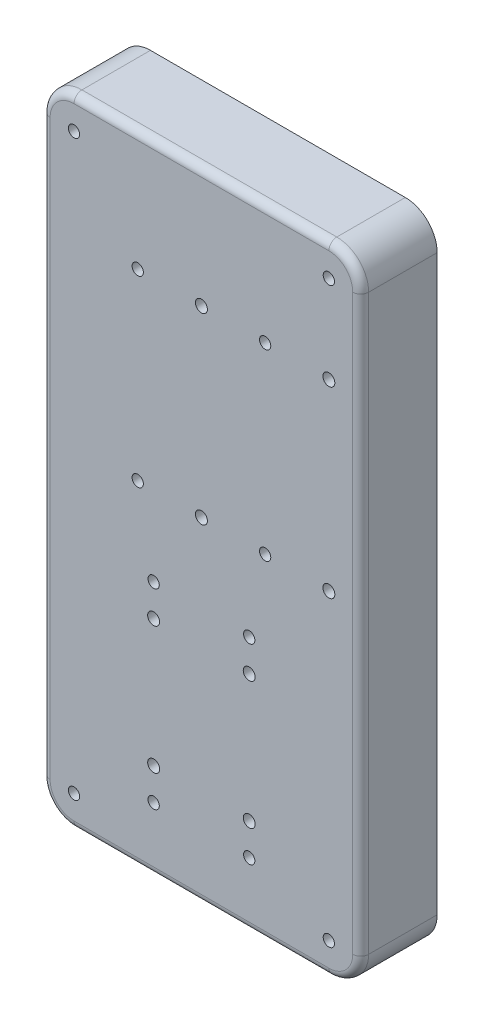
SolidWorks part; units mm, degrees
ref_plane "Front Plane" through (0, 0, 0) normal (0, 0, 1) x (1, 0, 0)
ref_plane "Top Plane" through (0, 0, 0) normal (0, 1, 0) x (1, 0, 0)
ref_plane "Right Plane" through (0, 0, 0) normal (1, 0, 0) x (0, 0, -1)
sketch "Sketch1" plane through (0, 0, 0) normal (0, 0, 1) x (1, 0, 0)
  line L0 (0, 0) -> (63.5, 0) construction
  line L1 (-63.5, 127) -> (63.5, 127)
  line L2 (-63.5, 127) -> (-63.5, -127)
  line L3 (-63.5, -127) -> (63.5, -127)
  line L4 (63.5, 127) -> (63.5, -127)
  line L5 (0, 0) -> (0, 62.3384) construction
  dimension "D1" = 254
  dimension "D2" = 127
extrude "Extrude1" add sketch "Sketch1" along normal blind 30.48
hole_wizard "CSK for #8 Flat Head Machine Screw1" positions "Sketch3" profile "Sketch2" countersink size "#8" standard "Ansi Inch"
sketch "Sketch3" plane through (0, 0, 0) normal (0, 0, -1) x (-1, 0, 0)
  line L0 (0, 0) -> (0, 58.5095) construction
  line L1 (0, 0) -> (26.0664, 0) construction
  point P0 (25.4, 79.375)
  point P1 (-25.4, 79.375)
  point P3 (25.4, 6.35)
  point P5 (-25.4, 6.35)
  point P14 (-19.05, -25.4)
  point P16 (-19.05, -101.6)
  point P18 (19.05, -101.6)
  point P20 (19.05, -25.4)
  dimension "D1" = 50.8
  dimension "D2" = 73.025
  dimension "D3" = 79.375
  dimension "D4" = 76.2
  dimension "D5" = 38.1
  dimension "D6" = 25.4
sketch "Sketch2" plane through (-25.4, 79.375, 0) normal (1, 0, 0) x (0, 1, 0)
  line L0 (0, 0) -> (0, 30.48)
  line L1 (0, 30.48) -> (2.2479, 30.48)
  line L2 (2.2479, 30.48) -> (2.2479, 3.0265)
  line L3 (2.2479, 3.0265) -> (4.8788, 0)
  line L5 (4.8788, 0) -> (0, 0)
  line L6 (-2.2479, 3.0265) -> (-4.8788, 0) construction
  line L11 (0, -6.35) -> (0, 107.95) construction
  dimension "Thru Hole Dia." = 4.4958
  dimension "Thru Hole Depth" = 30.48
  dimension "Near C'Sink Dia." = 9.7576
  dimension "Near C'Sink Angle" = 82
sketch "Sketch4" plane through (0, 0, 0) normal (0, 0, -1) x (-1, 0, 0)
  line L0 (-25.4, 79.375) -> (25.4, 79.375) construction
  line L1 (-25.4, 6.35) -> (25.4, 6.35) construction
  line L2 (19.05, -101.6) -> (19.05, -25.4) construction
  line L3 (-19.05, -25.4) -> (-19.05, -101.6) construction
  circle A5 centre (19.05, -101.6) radius 2.2479 construction
  circle A6 centre (25.4, 79.375) radius 2.2479 construction
  circle A7 centre (-25.4, 6.35) radius 2.2479 construction
  circle A8 centre (19.05, -25.4) radius 2.2479 construction
  circle A9 centre (-19.05, -101.6) radius 2.2479 construction
  circle A10 centre (19.05, -88.9) radius 2.3813
  circle A11 centre (19.05, -38.1) radius 2.3813
  circle A12 centre (-19.05, -38.1) radius 2.3813
  circle A13 centre (-19.05, -88.9) radius 2.3813
  circle A14 centre (0, 6.35) radius 2.3813
  circle A15 centre (-50.8, 6.35) radius 2.3812
  circle A16 centre (-50.8, 79.375) radius 2.3812
  circle A17 centre (0, 79.375) radius 2.3812
  dimension "D1" = 4.7625
  dimension "D2" = 25.4
  dimension "D3" = 25.4
  dimension "D4" = 12.7
  dimension "D5" = 12.7
extrude "Cut-Extrude1" cut sketch "Sketch4" against normal through all
fillet "Fillet1" radius 12.7 4 edges at (-63.5, 127, 15.24) (63.5, 127, 15.24) (63.5, -127, 15.24) (-63.5, -127, 15.24)
fillet "Fillet2" radius 3.175 8 edges at (59.7803, -123.2803, 30.48) (0, -127, 30.48) (-59.7803, -123.2803, 30.48) (-63.5, 0, 30.48) (-59.7803, 123.2803, 30.48) (0, 127, 30.48) (59.7803, 123.2803, 30.48) (63.5, 0, 30.48)
hole_wizard "#8 Clearance Hole1" positions "Sketch6" profile "Sketch5" hole size "#8" standard "Ansi Inch"
sketch "Sketch6" plane through (0, 0, 30.48) normal (0, 0, 1) x (1, 0, 0)
  line L0 (0, 0) -> (0, 105.9704) construction
  line L1 (0, 0) -> (100.393, 0) construction
  point P0 (-50.8, 114.3)
  point P1 (50.8, 114.3)
  point P3 (50.8, -114.3)
  point P5 (-50.8, -114.3)
  dimension "D1" = 101.6
  dimension "D2" = 228.6
sketch "Sketch5" plane through (-50.8, 114.3, 30.48) normal (1, 0, 0) x (0, -1, 0)
  line L0 (0, 0) -> (0, 30.48)
  line L1 (0, 30.48) -> (2.2479, 30.48)
  line L2 (2.2479, 30.48) -> (2.2479, 0)
  line L5 (2.2479, 0) -> (0, 0)
  line L11 (0, -6.35) -> (0, 107.95) construction
  dimension "Thru Hole Dia." = 4.4958
  dimension "Thru Hole Depth" = 30.48
